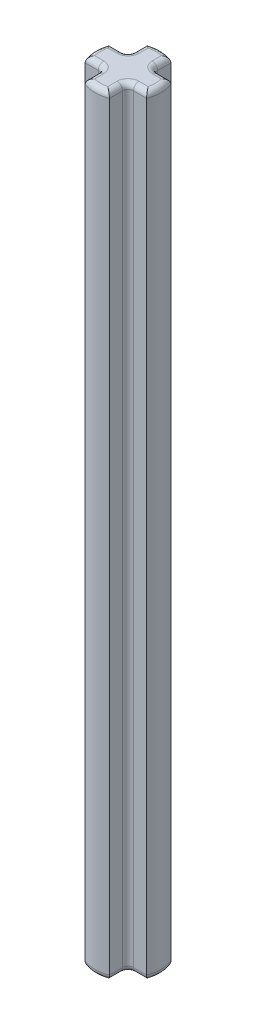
SolidWorks part; units mm, degrees
ref_plane "정면" through (0, 0, 0) normal (0, 0, 1) x (1, 0, 0)
ref_plane "윗면" through (0, 0, 0) normal (0, 1, 0) x (1, 0, 0)
ref_plane "우측면" through (0, 0, 0) normal (1, 0, 0) x (0, 0, -1)
sketch "스케치1" plane through (0, 0, 0) normal (0, 0, 1) x (1, 0, 0)
  line L0 (2.4, 56) -> (0, 56)
  line L1 (0, 56) -> (0, 0)
  line L2 (0, 0) -> (2.4, 0)
  line L3 (2.4, 0) -> (2.4, 56)
  line L4 (0, 56) -> (0, 0) construction
  dimension "D1" = 2.4
  dimension "D2" = 56
revolve "회전1" add sketch "스케치1" angle 360 about L4
sketch "스케치2" plane through (0, 56, 0) normal (0, 1, 0) x (-1, 0, 0)
  line L0 (0.88, 2.2328) -> (0.88, 0.88)
  line L1 (0.88, 0.88) -> (2.2328, 0.88)
  arc A0 (2.2328, 0.88) -> (0.88, 2.2328) centre (0, 0) ccw
extrude "컷-돌출1" cut sketch "스케치2" against normal through all
sketch "스케치3" plane through (0, 56, 0) normal (0, 1, 0) x (-1, 0, 0)
  line L0 (2.2328, -0.88) -> (0.88, -0.88)
  line L1 (0.88, -0.88) -> (0.88, -2.2328)
  arc A0 (0.88, -2.2328) -> (2.2328, -0.88) centre (0, 0) ccw
extrude "컷-돌출2" cut sketch "스케치3" against normal through all
sketch "스케치4" plane through (0, 56, 0) normal (0, 1, 0) x (-1, 0, 0)
  line L0 (-0.88, -2.2328) -> (-0.88, -0.88)
  line L1 (-0.88, -0.88) -> (-2.2328, -0.88)
  arc A0 (-2.2328, -0.88) -> (-0.88, -2.2328) centre (0, 0) ccw
extrude "컷-돌출3" cut sketch "스케치4" against normal through all
sketch "스케치5" plane through (0, 56, 0) normal (0, 1, 0) x (-1, 0, 0)
  line L0 (-2.2328, 0.88) -> (-0.88, 0.88)
  line L1 (-0.88, 0.88) -> (-0.88, 2.2328)
  arc A0 (-0.88, 2.2328) -> (-2.2328, 0.88) centre (0, 0) ccw
extrude "컷-돌출4" cut sketch "스케치5" against normal through all
fillet "필렛1" radius 0.4 28 edges at (0.88, 0, -1.5564) (1.5564, 0, -0.88) (2.4, 0, 0) (0, 0, -2.4) (1.5564, 0, 0.88) (0.88, 0, 1.5564) (-0.88, 0, -1.5564) (-2.4, 0, 0) (-1.5564, 0, -0.88) (0, 0, 2.4) (-0.88, 0, 1.5564) (-1.5564, 0, 0.88) (0, 56, -2.4) (-0.88, 56, -1.5564) (-1.5564, 56, -0.88) (1.5564, 56, -0.88) (0.88, 28, -0.88) (0.88, 56, -1.5564) (-2.4, 56, 0) (2.4, 56, 0) (-1.5564, 56, 0.88) (-0.88, 56, 1.5564) (1.5564, 56, 0.88) (0.88, 56, 1.5564) (0.88, 28, 0.88) (0, 56, 2.4) (-0.88, 28, -0.88) (-0.88, 28, 0.88)
